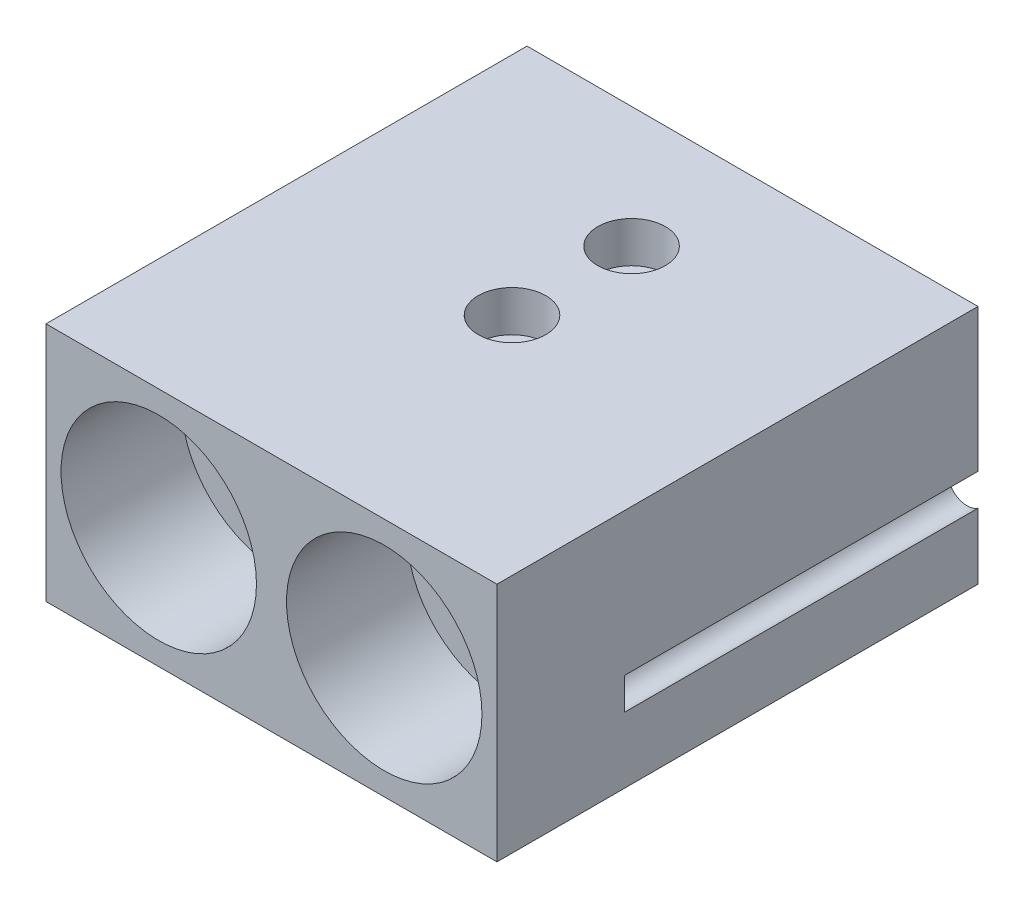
SolidWorks part; units mm, degrees
ref_plane "Front Plane" through (0, 0, 0) normal (0, 0, 1) x (1, 0, 0)
ref_plane "Top Plane" through (0, 0, 0) normal (0, 1, 0) x (1, 0, 0)
ref_plane "Right Plane" through (0, 0, 0) normal (1, 0, 0) x (0, 0, -1)
sketch "Sketch1" plane through (0, 0, 0) normal (0, 0, 1) x (1, 0, 0)
  line L1 (-23.8125, 12.7) -> (23.8125, 12.7)
  line L2 (-23.8125, 12.7) -> (-23.8125, -12.7)
  line L3 (-23.8125, -12.7) -> (23.8125, -12.7)
  line L4 (23.8125, 12.7) -> (23.8125, -12.7)
  dimension "D1" = 47.625
  dimension "D2" = 25.4
  dimension "D3" = 12.7
  dimension "D4" = 23.8125
extrude "Extrude1" add sketch "Sketch1" against normal blind 50.8
sketch "Sketch2" plane through (0, 0, 0) normal (0, 0, 1) x (1, 0, 0)
  line L0 (23.8125, 12.7) -> (-23.8125, 12.7) construction
  circle A0 centre (11.9062, 0) radius 7.1438
  circle A1 centre (-11.9062, 0) radius 7.1438
  dimension "D1" = 14.2875
  dimension "D2" = 14.2875
  dimension "D4" = 11.9062
  dimension "D6" = 12.7
  dimension "D3" = 11.9062
  dimension "D5" = 12.7
extrude "Cut-Extrude1" cut sketch "Sketch2" against normal through all
sketch "Sketch3" plane through (0, 0, 0) normal (0, 0, 1) x (1, 0, 0)
  circle A0 centre (11.9062, 0) radius 10.3187
  circle A1 centre (-11.9062, 0) radius 10.3187
  dimension "D1" = 20.6375
  dimension "D2" = 20.6375
extrude "Cut-Extrude2" cut sketch "Sketch3" against normal blind 12.7
hole_wizard "#10-32 Tapped Hole1" positions "Sketch6" profile "Sketch5" tap size "#10-32" standard "Ansi Inch"
sketch "Sketch6" plane through (0, -12.7, 0) normal (0, -1, 0) x (1, 0, 0)
  line L0 (-23.8125, -50.8) -> (23.8125, -50.8) construction
  point P0 (0, -38.1)
  point P1 (0, -25.4)
  dimension "D1" = 25.4
  dimension "D2" = 12.7
sketch "Sketch5" plane through (0, -12.7, -38.1) normal (1, 0, 0) x (0, 0, -1)
  line L0 (0, 0) -> (0, 25.4)
  line L1 (0, 25.4) -> (2.0193, 25.4)
  line L2 (2.0193, 25.4) -> (2.0193, 0)
  line L5 (2.0193, 0) -> (0, 0)
  line L11 (0, -6.35) -> (0, 107.95) construction
  dimension "Thru Tap Drill Dia." = 4.0386
  dimension "Thru Tap Drill Depth" = 25.4
sketch "Sketch7" plane through (0, 12.7, 0) normal (0, 1, 0) x (1, 0, 0)
  circle A0 centre (0, 38.0262) radius 3.5719
  circle A1 centre (0, 25.4) radius 3.5719
  dimension "D1" = 7.1437
  dimension "D2" = 7.1437
extrude "Cut-Extrude3" cut sketch "Sketch7" against normal blind 4.318
hole_wizard "#6-32 Tapped Hole1" positions "Sketch10" profile "Sketch9" tap size "#6-32" standard "Ansi Inch"
sketch "Sketch10" plane through (0, 0, -50.8) normal (0, 0, -1) x (-1, 0, 0)
  point P0 (-19.8374, 8.7122)
  point P1 (19.8374, 8.7122)
  point P3 (19.8374, -8.7376)
  point P5 (-19.8374, -8.7376)
  point P11 (0, 0)
  dimension "D1" = 8.7122
  dimension "D2" = 19.8374
  dimension "D3" = 19.8374
  dimension "D4" = 19.8374
  dimension "D5" = 19.8374
  dimension "D6" = 8.7122
  dimension "D7" = 17.4498
  dimension "D8" = 17.4498
sketch "Sketch9" plane through (19.8374, 8.7122, -50.8) normal (1, 0, 0) x (0, 1, 0)
  line L0 (0, 0) -> (0, 14.3255)
  line L1 (0, 14.3255) -> (1.3525, 13.5128)
  line L2 (1.3525, 13.5128) -> (1.3525, 0)
  line L5 (1.3525, 0) -> (0, 0)
  line L10 (0, 14.3255) -> (-1.3526, 13.5128) construction
  line L11 (0, -6.35) -> (0, 107.95) construction
  dimension "Tap Drill Dia." = 2.7051
  dimension "Tap Drill Depth" = 13.5128
  dimension "Drill Angle" = 118
sketch "Sketch11" plane through (0, 0, -50.8) normal (0, 0, -1) x (-1, 0, 0)
  line L0 (23.8125, -12.7) -> (-23.8125, -12.7) construction
  circle A0 centre (-22.6568, -4.064) radius 2.0447
  circle A1 centre (22.6568, -4.064) radius 2.0447
  dimension "D1" = 4.0894
  dimension "D2" = 4.0894
  dimension "D3" = 8.636
  dimension "D4" = 8.636
  dimension "D6" = 22.6568
  dimension "D5" = 22.6568
extrude "Cut-Extrude4" cut sketch "Sketch11" against normal blind 37.338
sketch "Sketch12" plane through (0, -12.7, 0) normal (0, -1, 0) x (1, 0, 0)
  line L0 (-23.8125, -50.8) -> (23.8125, -50.8) construction
  circle A0 centre (21.4376, -31.75) radius 1.6129
  circle A1 centre (-21.4376, -31.75) radius 1.6129
  dimension "D1" = 3.2258
  dimension "D2" = 3.2258
  dimension "D3" = 19.05
  dimension "D4" = 19.05
  dimension "D5" = 21.4376
  dimension "D6" = 21.4376
extrude "Cut-Extrude5" cut sketch "Sketch12" against normal blind 6.35
ref_plane "Plane1" through (0, 12.7, 0) normal (0, 1, 0) x (-1, 0, 0)
sketch "Sketch13"
sketch "Sketch15"
